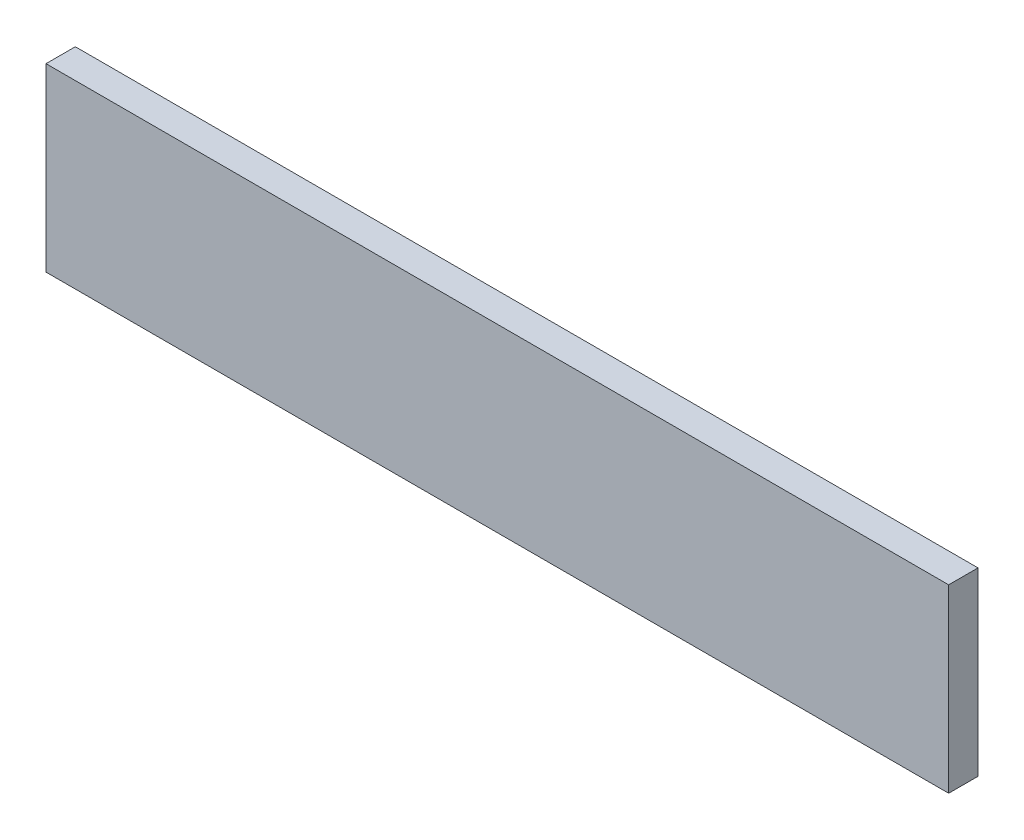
SolidWorks part; units mm, degrees
ref_plane "Front Plane" through (0, 0, 0) normal (1, 0, 0) x (0, 1, 0)
ref_plane "Top Plane" through (0, 0, 0) normal (0, 0, 1) x (0, 1, 0)
ref_plane "Right Plane" through (0, 0, 0) normal (0, 1, 0) x (-1, 0, 0)
sketch "Sketch1" plane through (0, 0, 0) normal (0, 0, 1) x (0, 1, 0)
  line L1 (-25.4, 127) -> (25.4, 127)
  line L2 (-25.4, 127) -> (-25.4, -127)
  line L3 (-25.4, -127) -> (25.4, -127)
  line L4 (25.4, 127) -> (25.4, -127)
  line L5 (-25.4, 127) -> (25.4, -127) construction
  line L6 (-25.4, -127) -> (25.4, 127) construction
  point P0 (0, 0)
  dimension "D1" = 50.8
  dimension "D2" = 254
extrude "Boss-Extrude1" add sketch "Sketch1" along normal blind 8.255
